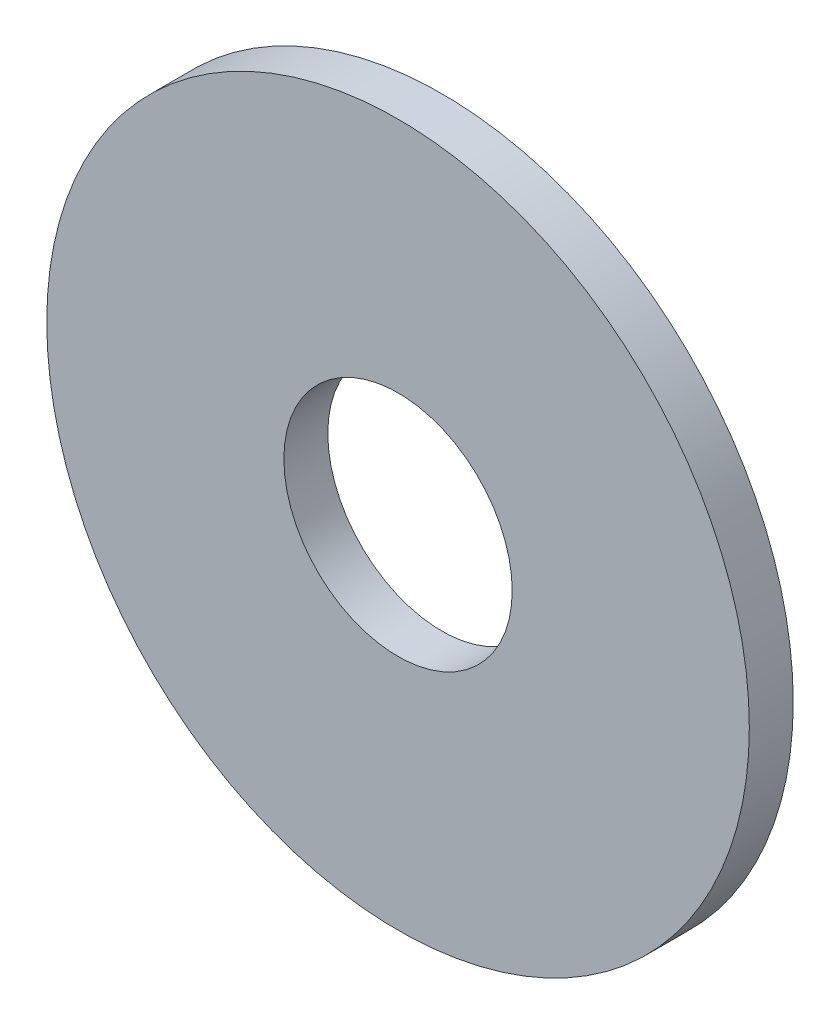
SolidWorks part; units mm, degrees
ref_plane "Plan1" through (0, 0, 0) normal (0, 0, 1) x (1, 0, 0)
ref_plane "Plan2" through (0, 0, 0) normal (0, 1, 0) x (1, 0, 0)
ref_plane "Plan3" through (0, 0, 0) normal (1, 0, 0) x (0, 0, -1)
extrude "Corps" add sketch "E_corps" along normal blind 2.5
sketch "E_corps" plane through (0, 0, 0) normal (0, 0, 1) x (1, 0, 0)
  circle A0 centre (0, 0) radius 20
  dimension "Diam_base" = 40
extrude "Diamètre_nominal" cut sketch "E_perçage" against normal through all
sketch "E_perçage" plane through (0, 0, 0) normal (0, 0, -1) x (-1, 0, 0)
  circle A0 centre (0, 0) radius 6.5
  dimension "Diamètre_nominal" = 13
